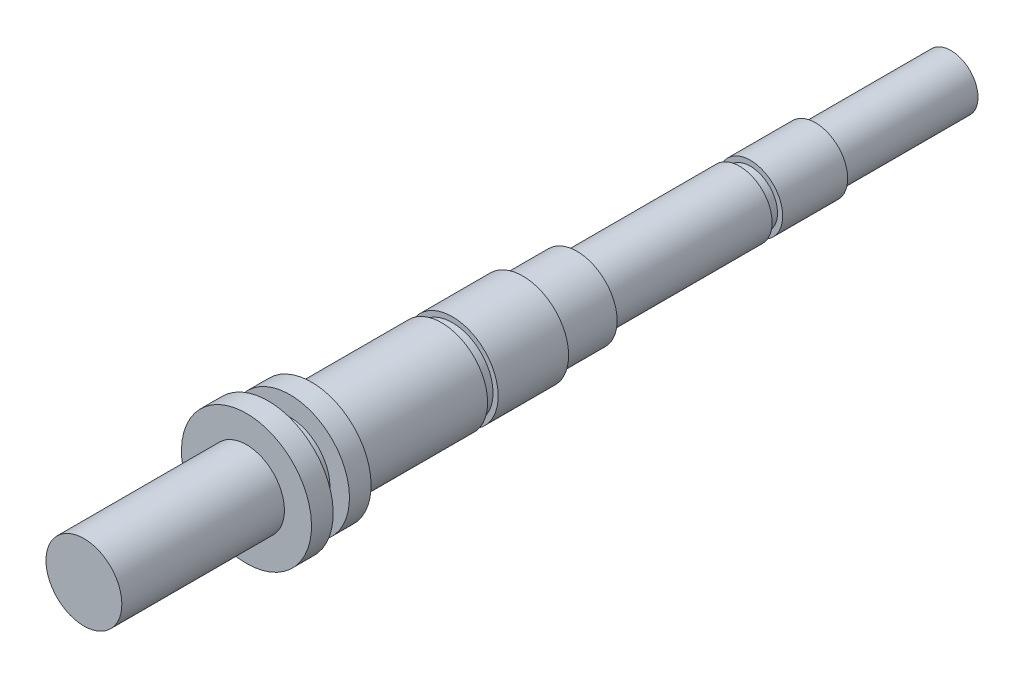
SolidWorks part; units mm, degrees
other "Inner Spindle"
other "7203 AngFr"
other "7203 AngRr"
other "Front Preload Nut"
other "6201 DgFr"
other "Spacer"
other "6201 DgRr"
other "Rear Preload"
other "Outer Spindle"
other "Lockring Front"
other "Lockring Rear"
other "Pulley"
ref_plane "Front Plane" through (0, 0, 0) normal (0, 0, 1) x (1, 0, 0)
ref_plane "Top Plane" through (0, 0, 0) normal (0, 1, 0) x (1, 0, 0)
ref_plane "Right Plane" through (0, 0, 0) normal (1, 0, 0) x (0, 0, -1)
sketch "Sketch1" plane through (0, 0, 0) normal (1, 0, 0) x (0, 0, -1)
  line L0 (-126.3943, 0) -> (126.3943, 0) construction
  line L1 (-50, 23.3253) -> (-50, -23.3253) construction
  line L2 (50, 19.03) -> (50, -19.03) construction
  line L3 (-82, 0) -> (-82, 7)
  line L4 (-82, 7) -> (-52, 7)
  line L5 (-52, 7) -> (-52, 12)
  line L6 (-52, 12) -> (-48, 12)
  line L7 (-48, 12) -> (-48, 7.4)
  line L8 (-48, 7.4) -> (-44, 7.4)
  line L9 (-44, 7.4) -> (-44, 11)
  line L10 (-44, 11) -> (-40, 11)
  line L11 (-40, 11) -> (-40, 8.5)
  line L12 (-40, 8.5) -> (-16, 8.5)
  line L15 (-1, 8.45) -> (-1, 7.4)
  line L17 (-1, 7.4) -> (9, 7.4)
  line L18 (9, 7.4) -> (9, 6)
  line L21 (53, 5.95) -> (53, 5)
  line L22 (53, 5) -> (78, 5)
  line L23 (78, 5) -> (78, 0)
  line L24 (-82, 0) -> (78, 0)
  line L26 (-16, 7.5) -> (-14, 7.5)
  line L27 (-14, 7.5) -> (-14, 8.45)
  line L28 (-14, 8.45) -> (-1, 8.45)
  line L29 (9, 6) -> (39, 6)
  line L30 (39, 6) -> (39, 5)
  line L31 (39, 5) -> (41, 5)
  line L32 (41, 5) -> (41, 5.95)
  line L33 (41, 5.95) -> (53, 5.95)
  line L34 (-16, 8.5) -> (-16, 7.5)
  point P4 (0, 0)
  point P7 (-50, 0)
  point P10 (50, 0)
  point P38 (-16, 8)
  dimension "D1" = 50
  dimension "D2" = 50
  dimension "D3" = 7
  dimension "D4" = 30
  dimension "D5" = 12
  dimension "D6" = 4
  dimension "D7" = 7.4
  dimension "D8" = 2
  dimension "D9" = 6
  dimension "D10" = 11
  dimension "D11" = 4
  dimension "D12" = 8.5
  dimension "D13" = 24
  dimension "D14" = 8.45
  dimension "D15" = 2
  dimension "D16" = 15
  dimension "D17" = 41
  dimension "D18" = 6
  dimension "D19" = 7.5
  dimension "D20" = 30
  dimension "D21" = 7.4
  dimension "D22" = 3
  dimension "D23" = 5
  dimension "D24" = 25
  dimension "D25" = 5.95
  dimension "D26" = 2
  dimension "D27" = 5
revolve "Revolve2" add sketch "Sketch1" angle 360 about L0
sketch "Sketch5" plane through (0, 0, 40) normal (0, 0, -1) x (-1, 0, 0)
  circle A0 centre (0, 0) radius 8.5 construction
  circle A1 centre (0, 0) radius 8.5
  circle A2 centre (0, 0) radius 20
  dimension "D1" = 40
extrude "Boss-Extrude1" add sketch "Sketch5" along normal blind 12 separate body
sketch "Sketch6" plane through (0, 0, 28) normal (0, 0, -1) x (-1, 0, 0)
  circle A0 centre (0, 0) radius 8.5 construction
  circle A1 centre (0, 0) radius 8.5
  circle A2 centre (0, 0) radius 20
  dimension "D1" = 40
extrude "Boss-Extrude2" add sketch "Sketch6" along normal blind 12 separate body
sketch "Sketch7" plane through (0, 0, 16) normal (0, 0, -1) x (-1, 0, 0)
  circle A0 centre (0, 0) radius 8.5 construction
  circle A1 centre (0, 0) radius 8.5
  circle A2 centre (0, 0) radius 11.5
  dimension "D1" = 23
extrude "Boss-Extrude3" add sketch "Sketch7" along normal blind 2 separate body
sketch "Sketch8" plane through (0, 0, 14) normal (0, 0, -1) x (-1, 0, 0)
  circle A0 centre (0, 0) radius 17.5
  circle A1 centre (0, 0) radius 8.5 construction
  circle A2 centre (0, 0) radius 8.5
  dimension "D1" = 35
extrude "Boss-Extrude4" add sketch "Sketch8" along normal blind 8
sketch "Sketch9" plane through (0, 0, -9) normal (0, 0, -1) x (-1, 0, 0)
  circle A0 centre (0, 0) radius 6 construction
  circle A1 centre (0, 0) radius 6
  circle A2 centre (0, 0) radius 16
  dimension "D1" = 32
extrude "Boss-Extrude5" add sketch "Sketch9" along normal blind 10 separate body
sketch "Sketch11" plane through (0, 0, -19) normal (0, 0, -1) x (-1, 0, 0)
  circle A0 centre (0, 0) radius 16 construction
  circle A1 centre (0, 0) radius 16
  circle A2 centre (0, 0) radius 14
  circle A3 centre (0, 0) radius 15.5
  dimension "D1" = 28
  dimension "D2" = 31
extrude "Boss-Extrude8" add sketch "Sketch11" along normal blind 10 separate body contours A3 A2
sketch "Sketch12" plane through (0, 0, -29) normal (0, 0, -1) x (-1, 0, 0)
  circle A0 centre (0, 0) radius 6 construction
  circle A1 centre (0, 0) radius 6
  circle A2 centre (0, 0) radius 16
  dimension "D1" = 32
extrude "Boss-Extrude9" add sketch "Sketch12" along normal blind 10 separate body
sketch "Sketch13" plane through (0, 0, -39) normal (0, 0, -1) x (-1, 0, 0)
  circle A0 centre (0, 0) radius 6 construction
  circle A1 centre (0, 0) radius 6
  circle A2 centre (0, 0) radius 9
  dimension "D1" = 18
extrude "Boss-Extrude10" add sketch "Sketch13" along normal blind 2 separate body
sketch "Sketch14" plane through (0, 0, -41) normal (0, 0, -1) x (-1, 0, 0)
  circle A0 centre (0, 0) radius 13
  circle A1 centre (0, 0) radius 6 construction
  circle A2 centre (0, 0) radius 6
  dimension "D1" = 26
extrude "Boss-Extrude11" add sketch "Sketch14" along normal blind 8
sketch "Sketch15" plane through (0, 0, 0) normal (0, 0, 1) x (1, 0, 0)
  circle A0 centre (0, 0) radius 24
  dimension "D1" = 48
extrude "Boss-Extrude12" add sketch "Sketch15" along normal mid plane 100 separate body
sketch "Sketch16" plane through (0, 0, -50) normal (0, 0, -1) x (-1, 0, 0)
  circle A0 centre (0, 0) radius 16
  dimension "D1" = 32
extrude "Cut-Extrude1" cut sketch "Sketch16" against normal up to next
sketch "Sketch17" plane through (0, 0, -50) normal (0, 0, -1) x (-1, 0, 0)
  circle A0 centre (0, 0) radius 21
  circle A1 centre (0, 0) radius 16 construction
  circle A2 centre (0, 0) radius 16
  dimension "D1" = 42
extrude "Cut-Extrude2" cut sketch "Sketch17" against normal blind 11
sketch "Sketch18" plane through (0, 0, 50) normal (0, 0, 1) x (1, 0, 0)
  circle A0 centre (0, 0) radius 20
  circle A1 centre (0, 0) radius 16 construction
  circle A2 centre (0, 0) radius 16
  dimension "D1" = 40
extrude "Cut-Extrude3" cut sketch "Sketch18" against normal blind 34
sketch "Sketch19" plane through (0, 0, 16) normal (0, 0, 1) x (1, 0, 0)
  circle A0 centre (0, 0) radius 18
  circle A1 centre (0, 0) radius 16 construction
  circle A2 centre (0, 0) radius 16
  dimension "D1" = 36
extrude "Cut-Extrude4" cut sketch "Sketch19" against normal blind 14
sketch "Sketch20" plane through (0, 0, 50) normal (0, 0, 1) x (1, 0, 0)
  circle A0 centre (0, 0) radius 21
  circle A1 centre (0, 0) radius 20 construction
  circle A2 centre (0, 0) radius 20
  dimension "D1" = 42
extrude "Cut-Extrude5" cut sketch "Sketch20" against normal blind 10
sketch "Sketch21" plane through (0, 0, 50) normal (0, 0, 1) x (1, 0, 0)
  circle A0 centre (0, 0) radius 16.1
  circle A1 centre (0, 0) radius 21 construction
  circle A2 centre (0, 0) radius 21
  dimension "D1" = 32.2
extrude "Boss-Extrude13" add sketch "Sketch21" against normal blind 10 separate body
sketch "Sketch22" plane through (0, 0, 50) normal (0, 0, 1) x (1, 0, 0)
  line L0 (0, -18.5) -> (0, 18.5) construction
  circle A0 centre (0, 0) radius 18.5 construction
  circle A1 centre (0, -18.5) radius 1.5
  circle A2 centre (0, 18.5) radius 1.5
  dimension "D1" = 37
  dimension "D2" = 3
extrude "Cut-Extrude6" cut sketch "Sketch22" against normal blind 5
sketch "Sketch23" plane through (0, 0, -50) normal (0, 0, -1) x (-1, 0, 0)
  circle A0 centre (0, 0) radius 13.5
  circle A1 centre (0, 0) radius 21 construction
  circle A2 centre (0, 0) radius 21
  dimension "D1" = 27
extrude "Boss-Extrude14" add sketch "Sketch23" against normal blind 10 separate body
sketch "Sketch24" plane through (0, 0, -50) normal (0, 0, -1) x (-1, 0, 0)
  line L0 (0, -18.5) -> (0, 18.5) construction
  circle A0 centre (0, 0) radius 18.5 construction
  circle A1 centre (0, -18.5) radius 1.5
  circle A2 centre (0, 18.5) radius 1.5
  dimension "D1" = 37
  dimension "D2" = 3
extrude "Cut-Extrude7" cut sketch "Sketch24" against normal blind 5 contours A1 | A2
sketch "Sketch26" plane through (0, 0, 0) normal (1, 0, 0) x (0, 0, -1)
  line L0 (78, -5) -> (78, 5) construction
  line L2 (50.5679, 0) -> (99.549, 0) construction
  line L4 (72, 15) -> (70.5, 15)
  line L5 (70.5, 15) -> (69.3453, 13)
  line L6 (69.3453, 13) -> (68.6547, 13)
  line L7 (68.6547, 13) -> (67.5, 15)
  line L8 (67.5, 15) -> (66, 15)
  line L9 (66, 15) -> (66, 10)
  line L10 (66, 10) -> (64.5, 10)
  line L11 (64.5, 10) -> (63.3453, 8)
  line L12 (63.3453, 8) -> (62.6547, 8)
  line L13 (62.6547, 8) -> (61.5, 10)
  line L14 (61.5, 10) -> (54.5, 10)
  line L15 (54.5, 10) -> (54.5, 5)
  line L16 (54.5, 5) -> (78, 5)
  line L17 (72, 15) -> (72, 20)
  line L19 (78, 20) -> (78, 5)
  line L20 (72, 20) -> (73.5, 20)
  line L21 (73.5, 20) -> (74.6547, 18)
  line L22 (74.6547, 18) -> (75.3453, 18)
  line L23 (75.3453, 18) -> (76.5, 20)
  line L24 (76.5, 20) -> (78, 20)
  line L25 (78, -5) -> (78, 5) construction
  point P19 (71.25, 15)
  point P28 (65.25, 10)
  dimension "D1" = 15
  dimension "D2" = 5
  dimension "D3" = 20
  dimension "D4" = 2
  dimension "D5" = 3
  dimension "D6" = 1.5
  dimension "D8" = 7
  dimension "D10" = 60
  dimension "D11" = 60
  dimension "D13" = 10
revolve "Revolve4" add sketch "Sketch26" angle 360 about L2
combine bodies "Combine1" operation type add bodies to combine 102 126 124 122 114 112 111 108 107 105 104 128
